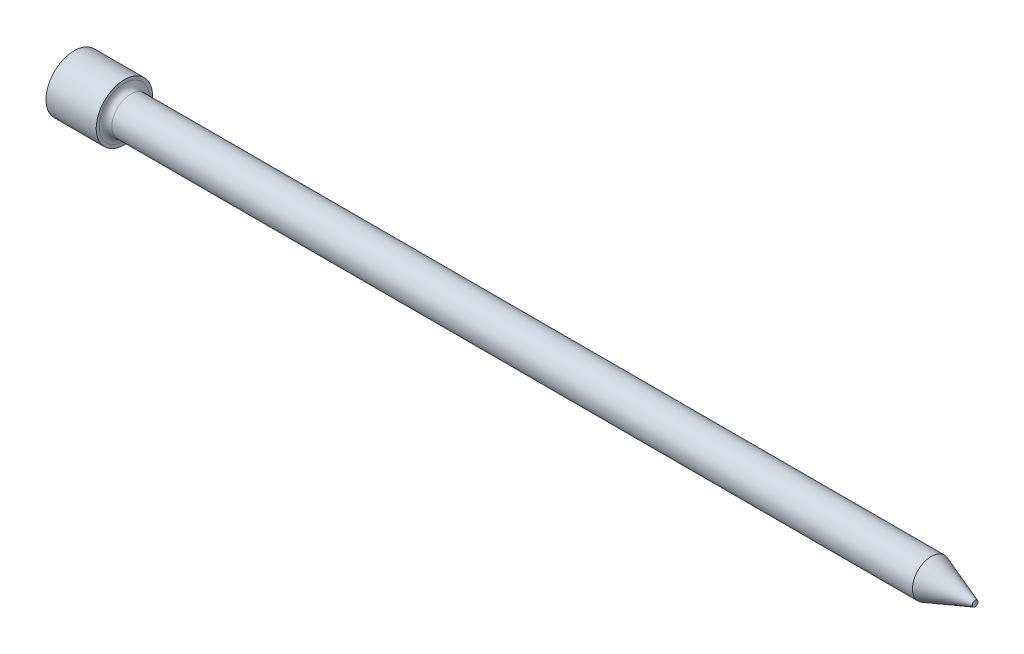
SolidWorks part; units mm, degrees
ref_plane "Front" through (0, 0, 0) normal (0, 0, 1) x (1, 0, 0)
ref_plane "Top" through (0, 0, 0) normal (0, 1, 0) x (1, 0, 0)
ref_plane "Right" through (0, 0, 0) normal (1, 0, 0) x (0, 0, -1)
imported_body "712-3-80"
sketch "Esquisse2" plane through (0, 0, 0) normal (0, 0, 1) x (1, 0, 0)
  line L0 (68.3333, 7.2345) -> (68.3333, -8.9316) construction
  line L1 (80, 1.5) -> (4.5, 1.5) construction
  line L2 (68.3333, 5.0636) -> (68.3333, -16.9386) construction
  line L3 (80, 1.5) -> (68.3333, 1.5)
  line L4 (68.3333, 1.5) -> (71.8333, 0.2261)
  line L5 (80, 0) -> (68.3333, 0) construction
  line L6 (80, -1.5) -> (80, 1.5) construction
  line L7 (71.8333, 0.2261) -> (71.8333, 0)
  line L8 (80, 1.5) -> (80, 0)
  line L9 (80, 0) -> (71.8333, 0)
  dimension "D1" = 20
  dimension "D2" = 3.5
revolve "Enlèvement de matière-Révolution1" cut sketch "Esquisse2" angle 360 about L5
